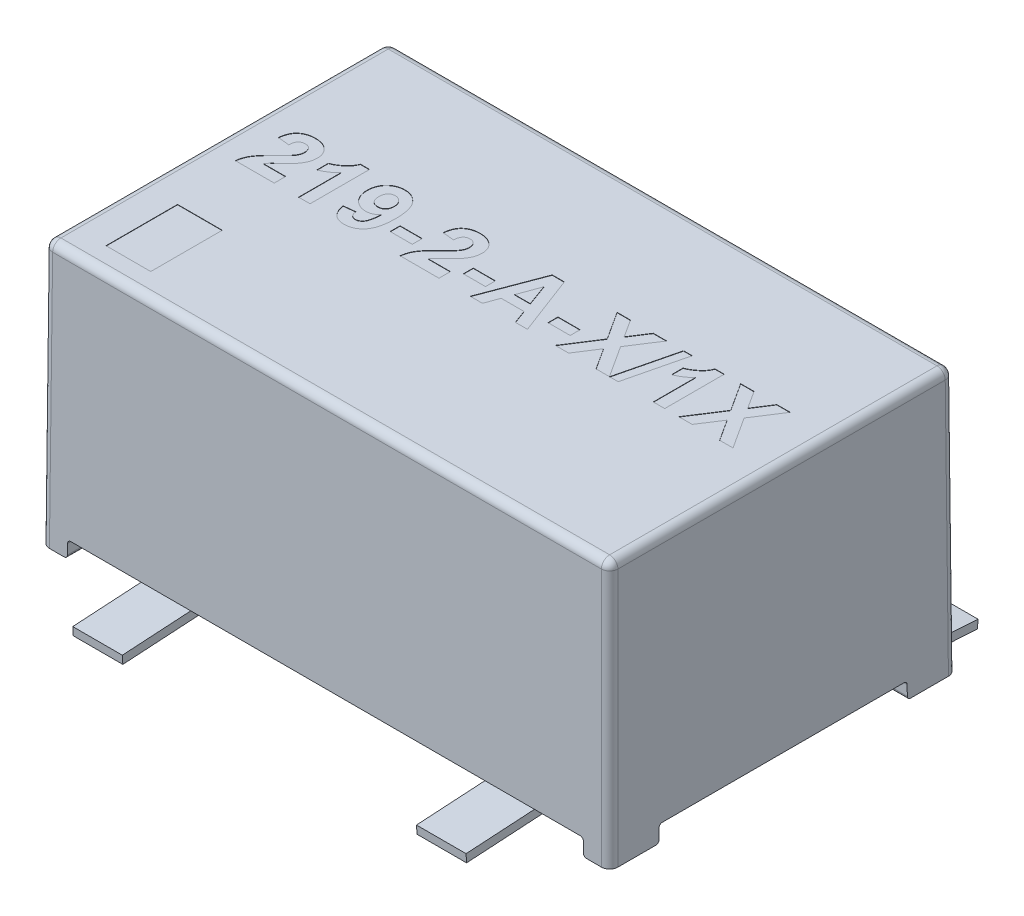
SolidWorks part; units mm, degrees
ref_plane "Front Plane" through (0, 0, 0) normal (0, 0, 1) x (1, 0, 0)
ref_plane "Top Plane" through (0, 0, 0) normal (0, 1, 0) x (1, 0, 0)
ref_plane "Right Plane" through (0, 0, 0) normal (1, 0, 0) x (0, 0, -1)
sketch "Sketch1" plane through (0, 0, 0) normal (0, 1, 0) x (1, 0, 0)
  line L1 (-8.6, -5.25) -> (8.6, -5.25)
  line L2 (-8.6, -5.25) -> (-8.6, 5.25)
  line L3 (-8.6, 5.25) -> (8.6, 5.25)
  line L4 (8.6, -5.25) -> (8.6, 5.25)
  line L5 (-8.6, -5.25) -> (8.6, 5.25) construction
  line L6 (-8.6, 5.25) -> (8.6, -5.25) construction
  point P0 (0, 0)
  dimension "D1" = 17.2
  dimension "D2" = 10.5
extrude "Main Body" add sketch "Sketch1" against normal blind 7.51
sketch "Sketch6" plane through (0, -7.51, 0) normal (0, -1, 0) x (1, 0, 0)
  line L0 (8.6, -5.25) -> (-8.6, -5.25) construction
  line L1 (8.1, 4.75) -> (-8.1, 4.75)
  line L2 (8.1, 4.75) -> (8.1, -4.75)
  line L3 (8.1, -4.75) -> (-8.1, -4.75)
  line L4 (-8.1, 4.75) -> (-8.1, -4.75)
  line L5 (8.1, 4.75) -> (-8.1, -4.75) construction
  line L6 (8.1, -4.75) -> (-8.1, 4.75) construction
  line L7 (-8.6, -5.25) -> (-8.6, 5.25) construction
  point P0 (0, 0)
  dimension "D1" = 0.5
  dimension "D2" = 0.5
sketch "Sketch2" plane through (0, -7.51, 0) normal (0, -1, 0) x (-1, 0, 0)
  line L1 (-8.1, -4.75) -> (-8.1, 4.75) construction
  line L17 (-8.6, 5.25) -> (-7.8, 5.25)
  line L18 (-8.6, 5.25) -> (8.6, 5.25) construction
  line L19 (-7.8, 5.25) -> (-7.8, 4.75)
  line L21 (-7.8, 4.75) -> (-8.1, 4.75)
  line L22 (-8.1, 4.75) -> (-8.1, 3.75)
  line L24 (-8.1, 3.75) -> (-8.6, 3.75)
  line L25 (-8.6, -5.25) -> (-8.6, 5.25) construction
  line L26 (-8.6, 3.75) -> (-8.6, 5.25)
  dimension "D1" = 0.8
  dimension "D2" = 1.5
  dimension "D3" = 0.5
  dimension "D4" = 1
extrude "Stand off foot" add sketch "Sketch2" along normal blind 0.5
mirror "Stand off Mirror1" about plane through (0, 0, 0) normal (1, 0, 0) of "Stand off foot"
mirror "Stand off Mirror2" about plane through (0, 0, 0) normal (0, 0, 1) of "Stand off Mirror1", "Stand off foot"
draft "0.36deg Draft" type of draft neutral plane draft angle 0.36 faces to draft 12 parameters "D1"=0.36
fillet "0.25mm Fillet1" radius 0.25 8 edges at (0, 0, 5.1997) (-8.5497, 0, 0) (0, 0, -5.1997) (8.5497, 0, 0) (8.5748, -4.005, 5.2248) (-8.5748, -4.005, 5.2248) (-8.5748, -4.005, -5.2248) (8.5748, -4.005, -5.2248)
draft "0.36 Inner Wall Draft" type of draft neutral plane draft angle 0.36 faces to draft 4 parameters "D1"=0.36
draft "0.36 Stand off Foot Draft" type of draft neutral plane draft angle 0.36 faces to draft 8 parameters "D1"=0.36
fillet "0.20mm Fillet1" radius 0.1 16 edges at (-8.3484, -7.51, -3.7531) (-8.3516, -8.01, -3.7563) (-7.8063, -8.01, -5) (-7.8031, -7.51, -4.9984) (7.8031, -7.51, -4.9984) (7.8063, -8.01, -5.0016) (8.3484, -7.51, -3.7531) (8.3516, -8.01, -3.7563) (8.3484, -7.51, 3.7531) (8.35, -8.01, 3.7563) (7.8031, -7.51, 4.9984) (7.8063, -8.01, 5) (-7.8063, -8.01, 5.0016) (-8.35, -8.01, 3.7563) (-8.3484, -7.51, 3.7531) (-7.8031, -7.51, 4.9984)
sketch "Sketch7" plane through (0, -7.51, 0) normal (0, -1, 0) x (1, 0, 0)
  line L0 (7.7038, -5.2469) -> (-7.7038, -5.2469) construction
  line L1 (7.55, -4.2069) -> (6.05, -4.2069)
  line L2 (7.55, -4.2069) -> (7.55, -3.9569)
  line L3 (7.55, -3.9569) -> (6.05, -3.9569)
  line L4 (6.05, -4.2069) -> (6.05, -3.9569)
  line L5 (2.85, -4.2069) -> (1.35, -4.2069)
  line L6 (2.85, -4.2069) -> (2.85, -3.9569)
  line L7 (2.85, -3.9569) -> (1.35, -3.9569)
  line L8 (1.35, -4.2069) -> (1.35, -3.9569)
  line L9 (-1.35, -4.2069) -> (-2.85, -4.2069)
  line L10 (-1.35, -4.2069) -> (-1.35, -3.9569)
  line L11 (-1.35, -3.9569) -> (-2.85, -3.9569)
  line L12 (-2.85, -4.2069) -> (-2.85, -3.9569)
  line L13 (-6.05, -4.2069) -> (-7.55, -4.2069)
  line L14 (-6.05, -4.2069) -> (-6.05, -3.9569)
  line L15 (-6.05, -3.9569) -> (-7.55, -3.9569)
  line L16 (-7.55, -4.2069) -> (-7.55, -3.9569)
  line L17 (5.95, 3.9569) -> (4.45, 3.9569)
  line L18 (5.95, 3.9569) -> (5.95, 4.2069)
  line L19 (5.95, 4.2069) -> (4.45, 4.2069)
  line L20 (4.45, 3.9569) -> (4.45, 4.2069)
  line L21 (-4.45, 3.9569) -> (-5.95, 3.9569)
  line L22 (-4.45, 3.9569) -> (-4.45, 4.2069)
  line L23 (-4.45, 4.2069) -> (-5.95, 4.2069)
  line L24 (-5.95, 3.9569) -> (-5.95, 4.2069)
  line L25 (8.6, -5) -> (8.6, -3.8557) construction
  line L26 (-8.6, -5) -> (-8.6, -3.8557) construction
  line L27 (-7.7038, 5.2469) -> (7.7038, 5.2469) construction
  line L28 (8.6, 5) -> (8.6, 3.8557) construction
  line L29 (-8.6, 5) -> (-8.6, 3.8557) construction
  point P34 (-5.95, 4.0819)
  dimension "D1" = 1.5
  dimension "D2" = 0.25
  dimension "D3" = 1.04
  dimension "D4" = 1.05
  dimension "D5" = 3.2
  dimension "D6" = 3.2
  dimension "D7" = 1.05
  dimension "D8" = 1.04
  dimension "D9" = 2.65
  dimension "D10" = 2.65
sketch "Sketch8" plane through (0, -7.51, 0) normal (0, -1, 0) x (-1, 0, 0)
  line L1 (-6.05, 3.9569) -> (-7.55, 3.9569)
  line L2 (-6.05, 3.9569) -> (-6.05, 4.2069)
  line L3 (-6.05, 4.2069) -> (-7.55, 4.2069)
  line L4 (-7.55, 3.9569) -> (-7.55, 4.2069)
  line L5 (-6.05, 3.9569) -> (-7.55, 4.2069) construction
  line L6 (-6.05, 4.2069) -> (-7.55, 3.9569) construction
  point P0 (-6.8, 4.0819)
sketch3d "3DSketch1"
  line L0 (6.8, -7.51, -4.0819) -> (6.8, -7.6072, -4.0819)
  line L1 (6.8, -7.9815, -4.434) -> (6.8, -8.1346, -6.9365)
  arc A0 (6.8, -7.6072, -4.0819) -> (6.8, -7.9815, -4.434) centre (6.8, -7.6072, -4.4569) ccw
  point P6 (6.8, -7.96, -4.0819)
  point P7 (7.175, -7.6072, -4.4569)
  dimension "D2" = 0.375
  dimension "D1" = 93.5
  dimension "D3" = 0.45
  dimension "D4" = 2.86
sweep "Customer Pin 1" add profiles "Sketch8" path "3DSketch1"
pattern_linear "LPattern1" count 2 spacing 4.7 along (-1, 0, 0) of "Customer Pin 1"
ref_plane "Plane1" through (0, 0, 0) normal (-1, 0, 0) x (0, 0, 1)
mirror "Mirror2" about plane through (0, 0, 0) normal (-1, 0, 0) of "LPattern1", "Customer Pin 1"
sketch "Sketch9" plane through (0, -7.51, 0) normal (0, -1, 0) x (1, 0, 0)
  line L1 (4.45, 4.2069) -> (5.95, 4.2069)
  line L2 (4.45, 4.2069) -> (4.45, 3.9569)
  line L3 (4.45, 3.9569) -> (5.95, 3.9569)
  line L4 (5.95, 4.2069) -> (5.95, 3.9569)
  line L5 (4.45, 4.2069) -> (5.95, 3.9569) construction
  line L6 (4.45, 3.9569) -> (5.95, 4.2069) construction
  point P0 (5.2, 4.0819)
sketch3d "3DSketch2"
  line L0 (5.2, -7.51, 4.0819) -> (5.2, -7.6072, 4.0819)
  line L1 (5.2, -7.9815, 4.434) -> (5.2, -8.1346, 6.9365)
  arc A0 (5.2, -7.6072, 4.0819) -> (5.2, -7.9815, 4.434) centre (5.2, -7.6072, 4.4569) ccw
  point P6 (5.2, -7.96, 4.0819)
  point P7 (4.825, -7.6072, 4.4569)
  dimension "D2" = 0.375
  dimension "D1" = 93.5
  dimension "D3" = 0.45
  dimension "D4" = 2.86
sweep "Customer Pin 2" add profiles "Sketch9" path "3DSketch2"
mirror "Mirror3" about plane through (0, 0, 0) normal (-1, 0, 0) of "Customer Pin 2"
sketch "Sketch10" plane through (0, 0, 0) normal (0, 1, 0) x (1, 0, 0)
  line L0 (-7.7815, -0.2864) -> (10.4709, -0.2864) construction
  line L1 (-7.4155, -2.3074) -> (-6.0629, -2.3074)
  line L2 (-7.4155, -2.3074) -> (-7.4155, -4.4716)
  line L3 (-7.4155, -4.4716) -> (-6.0629, -4.4716)
  line L4 (-6.0629, -2.3074) -> (-6.0629, -4.4716)
  text T0 "219-2-A-X/1X" font "Arial" height 1.8
extrude "Text" cut sketch "Sketch10" against normal blind 0.01
